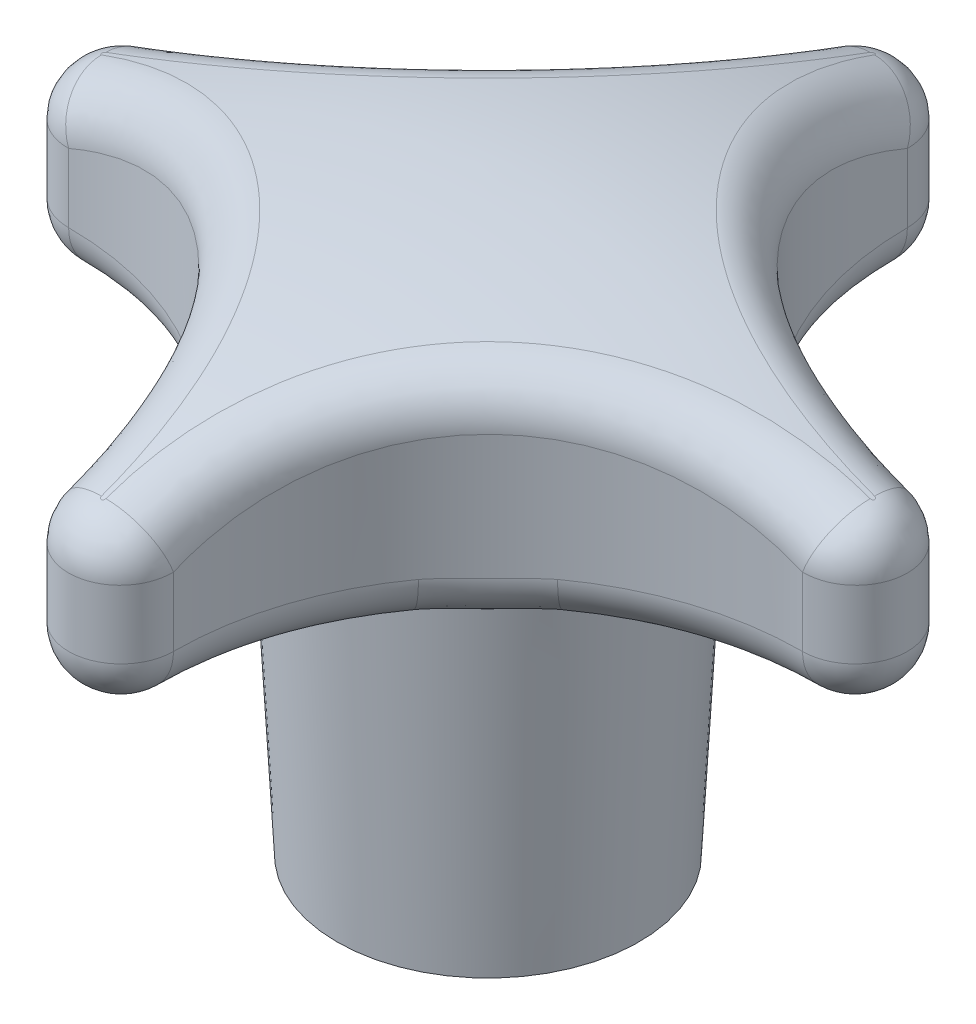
SolidWorks part; units mm, degrees
ref_plane "Front Plane" through (0, 0, 0) normal (0, 0, 1) x (1, 0, 0)
ref_plane "Top Plane" through (0, 0, 0) normal (0, 1, 0) x (1, 0, 0)
ref_plane "Right Plane" through (0, 0, 0) normal (1, 0, 0) x (0, 0, -1)
sketch "Sketch1" plane through (0, 0, 0) normal (0, 1, 0) x (1, 0, 0)
  circle A0 centre (0, 0) radius 9
  dimension "D1" = 18
extrude "Extrude1" add sketch "Sketch1" against normal blind 20
draft "Draft1" type of draft neutral plane draft angle 3 faces to draft 1 parameters "D1"=3
sketch "Sketch2" plane through (0, 0, 0) normal (0, 0, 1) x (1, 0, 0)
  line L0 (0, 0) -> (-25, 0)
  line L1 (-25, 0) -> (-25, 9.1)
  line L2 (0, 0) -> (0, 50000) construction
  line L3 (0, 14) -> (20.2547, 14) construction
  line L4 (0, 0) -> (0, 14)
  arc A0 (0, 14) -> (-25, 9.1) centre (0, -52.2255) ccw
revolve "Revolve1" add sketch "Sketch2" angle 360 about L2
sketch "Sketch4" plane through (0, 0, 0) normal (0, 1, 0) x (1, 0, 0)
  line L0 (0, 0) -> (-50000, 0) construction
  line L1 (0, 0) -> (0, 50000) construction
  line L2 (-21.875, 3.125) -> (-45.9117, 3.125) construction
  line L3 (-3.125, 21.875) -> (-3.125, 40.3224) construction
  arc A0 (0, 25) -> (-3.125, 21.875) centre (0, 21.875) ccw
  arc A1 (-21.875, 3.125) -> (-25, 0) centre (-21.875, 0) ccw
  circle A2 centre (0, 0) radius 25 construction
  arc A3 (-21.875, 3.125) -> (-3.125, 21.875) centre (-21.875, 21.875) ccw
  arc A4 (0, 25) -> (-25, 0) centre (-25, 25) ccw
  point P9 (0, 25)
  point P10 (-25, 0)
  point P13 (-3.125, 21.875)
  point P14 (-21.875, 3.125)
extrude "Extrude3" cut sketch "Sketch4" along normal through all
pattern_circular "CirPattern1" count 4 over 360 about axis through (0, 0, 0) along (0, 1, 0) of "Extrude3"
fillet "Fillet2" radius 3 16 edges at (0, 0, 25) (8.6167, 0, 8.6167) (25, 0, 0) (8.6167, 0, -8.6167) (0, 0, -25) (-8.6167, 0, -8.6167) (-25, 0, 0) (-0.0002, 9.1, 25) (10.5886, 12.7826, 6.9024) (25, 9.1, 0.0002) (6.9024, 12.7826, -10.5886) (0.0002, 9.1, -25) (-10.5886, 12.7826, -6.9024) (-25, 9.1, 0.0002) (-8.6167, 0, 8.6167) (-6.9024, 12.7826, 10.5886)
sketch "Sketch6" plane through (0, -20, 0) normal (0, -1, 0) x (1, 0, 0)
  circle A0 centre (0, 0) radius 5
  dimension "D1" = 10
extrude "Extrude5" cut sketch "Sketch6" against normal blind 21
sketch "Sketch7" plane through (0, 0, 0) normal (0, 0, 1) x (1, 0, 0)
  line L0 (-0.125, 1) -> (5, 1)
  line L1 (5, -20) -> (5, 1) construction
  line L2 (5, 1) -> (-0.125, 3.9589)
  line L3 (-0.125, 3.9589) -> (-0.125, 1)
  line L4 (-5, -20) -> (5, -20) construction
revolve "Cut-Revolve1" cut sketch "Sketch7" angle 360 about L3
sketch "Sketch10" plane through (0, -20, 0) normal (0, -1, 0) x (1, 0, 0)
  circle A0 centre (0, 0) radius 4.25
  dimension "D1" = 8.5
extrude "Extrude8" cut sketch "Sketch10" against normal blind 21
sketch "Sketch11" [suppressed] plane through (0, 0, 0) normal (0, 0, 1) x (1, 0, 0)
  line L0 (0, 4) -> (7, 4)
  line L1 (-7, 4) -> (7, 4) construction
  line L2 (7, 4) -> (0, 8.0415)
  line L3 (0, 8.0415) -> (0, 4)
  dimension "D1" = 30
revolve "Cut-Revolve2" [suppressed] cut sketch "Sketch11" angle 360 about L3
equation "\"D2@Sketch2\" = \"D1@Sketch2\"*.65"
equation "\"D1@Sketch4\" = (\"D3@Sketch2\"*2)/8"
equation "\"D2@Sketch4\" =( \"D3@Sketch2\"*2)/8"
equation "\"D1@Sketch7\" = \"D1@Extrude5\""
